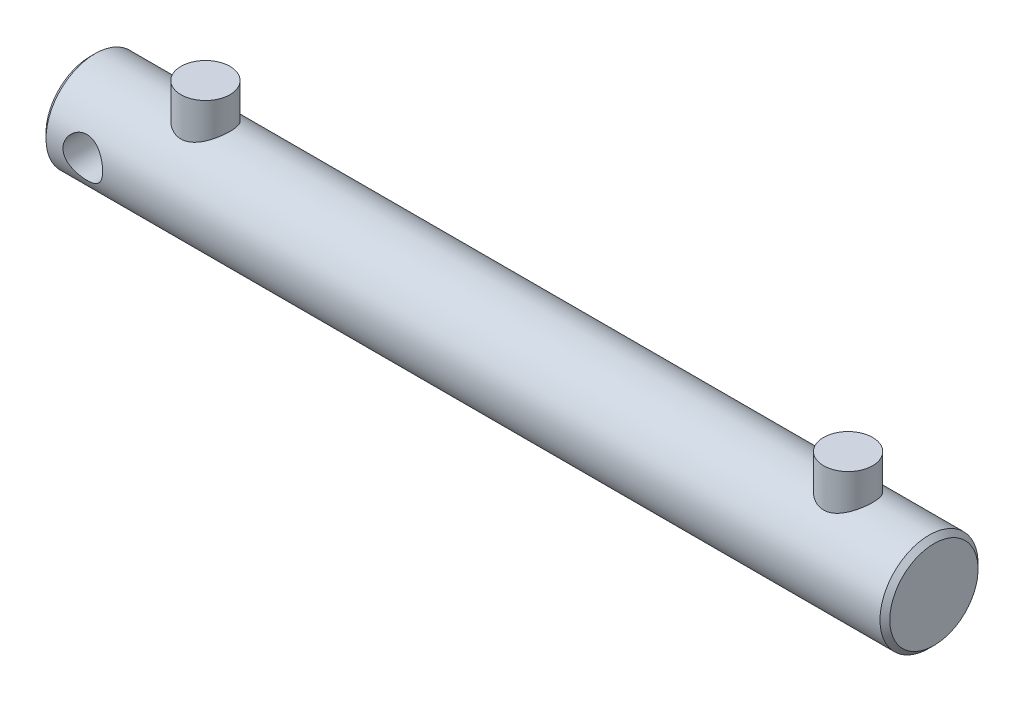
SolidWorks part; units mm, degrees
ref_plane "Plan de face" through (0, 0, 0) normal (0, 0, 1) x (1, 0, 0)
ref_plane "Plan de dessus" through (0, 0, 0) normal (0, 1, 0) x (1, 0, 0)
ref_plane "Plan de droite" through (0, 0, 0) normal (1, 0, 0) x (0, 0, -1)
sketch "Esquisse1" plane through (0, 0, 0) normal (0, 0, 1) x (1, 0, 0)
  line L0 (-172, 0) -> (172, 0) construction
  line L1 (-172, 0) -> (-172, 20)
  line L2 (-172, 20) -> (172, 20)
  line L3 (172, 20) -> (172, 0)
  line L6 (-172, 0) -> (172, 0)
  dimension "D1" = 40
  dimension "D3" = 344
revolve "Révolution1" add sketch "Esquisse1" angle 360 about L0
chamfer "Chanfrein1" distance 2 angle 45 2 edges at (172, 0, 20) (-172, 0, 20)
sketch "Esquisse3" plane through (0, 0, 0) normal (0, 0, 1) x (1, 0, 0)
  line L0 (-172, 18) -> (-172, -18) construction
  circle A0 centre (-155, 0) radius 8.1
  dimension "D1" = 16.2
  dimension "D2" = 17
extrude "Enlèv. mat.-Extru.1" cut sketch "Esquisse3" against normal through all and the other way through all
sketch "Esquisse5" plane through (0, 0, 0) normal (0, 1, 0) x (1, 0, 0)
  line L0 (-172, 18) -> (-172, -18) construction
  line L1 (172, -18) -> (172, 18) construction
  circle A0 centre (-125, 0) radius 10
  circle A1 centre (137, 0) radius 10
  dimension "D1" = 20
  dimension "D2" = 47
  dimension "D3" = 35
extrude "Extrusion2" add sketch "Esquisse5" along normal blind 33
